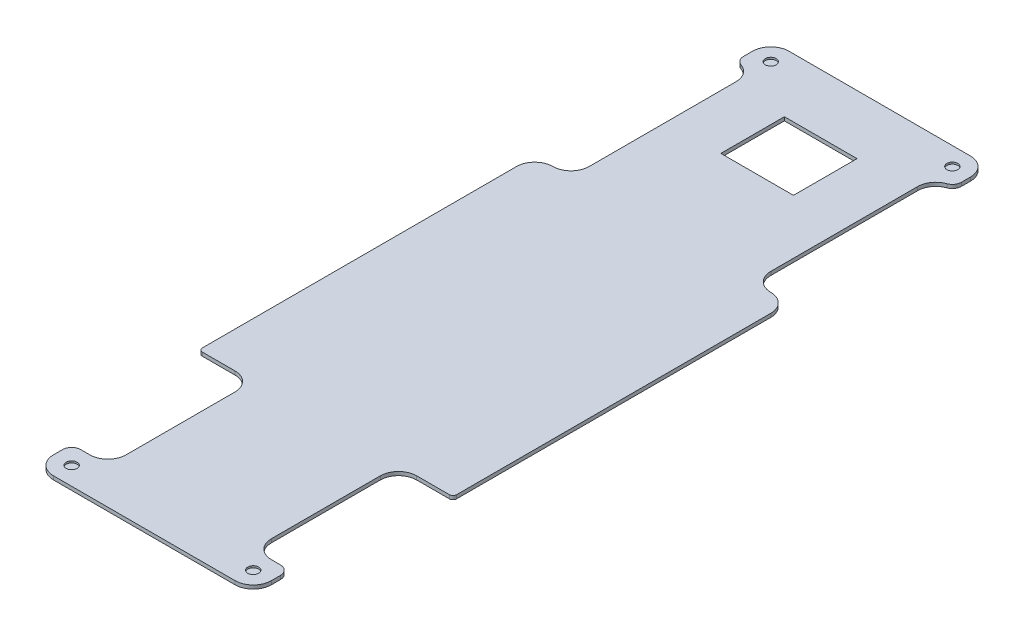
SolidWorks part; units mm, degrees
ref_plane "正面" through (0, 0, 0) normal (0, 0, 1) x (1, 0, 0)
ref_plane "平面" through (0, 0, 0) normal (0, 1, 0) x (1, 0, 0)
ref_plane "右側面" through (0, 0, 0) normal (1, 0, 0) x (0, 0, -1)
body saved out of another part "ｽﾄｯｸ-ORカー構想-1"
sketch "ｽｹｯﾁ1" plane through (0, -20, 0) normal (0, -1, 0) x (1, 0, 0)
  line L0 (40, 55) -> (-40, 55) construction
  line L1 (-50, 55) -> (50, 55)
  line L2 (-60, 45) -> (-60, 40)
  line L3 (-55, 35) -> (55, 35)
  line L4 (60, 45) -> (60, 40)
  line L5 (0, 55) -> (0, -350) construction
  line L6 (-60, 0) -> (-60, 71.566) construction
  line L7 (-50, -350) -> (50, -350) construction
  line L8 (-119.9521, -147.5) -> (119.9521, -147.5) construction
  line L9 (60, -340) -> (60, -335)
  line L10 (-55, -330) -> (55, -330)
  line L11 (-60, -340) -> (-60, -335)
  line L12 (-50, -350) -> (50, -350)
  arc A0 (-50, 55) -> (-60, 45) centre (-50, 45) ccw
  arc A1 (50, 55) -> (60, 45) centre (50, 45) cw
  arc A2 (-60, 40) -> (-55, 35) centre (-55, 40) ccw
  arc A3 (55, 35) -> (60, 40) centre (55, 40) ccw
  arc A4 (55, -330) -> (60, -335) centre (55, -335) cw
  arc A5 (-60, -335) -> (-55, -330) centre (-55, -335) cw
  arc A6 (50, -350) -> (60, -340) centre (50, -340) ccw
  arc A7 (-50, -350) -> (-60, -340) centre (-50, -340) cw
  point P16 (60, 55)
  point P21 (60, 35)
  point P26 (0, -147.5)
  point P39 (60, -330)
  point P40 (60, -350)
  dimension "D2" = 10
  dimension "D3" = 5
  dimension "D1" = 20
extrude "押し出し1" add sketch "ｽｹｯﾁ1" against normal up to surface (2 mm away)
fillet "ﾌｨﾚｯﾄ1" radius 10 10 edges at (50, -19, -330) (70, -19, -230) (50, -19, -230) (-50, -19, -330) (-50, -19, -230) (-70, -19, -230) (-40, -19, 35) (-40, -19, -45) (40, -19, -45) (40, -19, 35)
sketch "ｽｹｯﾁ3" plane through (0, -18, 0) normal (0, 1, 0) x (1, 0, 0)
  line L0 (68, 45) -> (70, 45)
  line L1 (70, 45) -> (70, 47)
  line L2 (-68, 45) -> (-70, 45)
  line L3 (-70, 45) -> (-70, 47)
  arc A0 (68, 45) -> (70, 47) centre (68, 47) ccw construction
  arc A1 (68, 45) -> (70, 47) centre (68, 47) ccw
  arc A2 (-70, 47) -> (-68, 45) centre (-68, 47) ccw construction
  arc A3 (-70, 47) -> (-68, 45) centre (-68, 47) ccw
extrude "ｶｯﾄ - 押し出し1" cut sketch "ｽｹｯﾁ3" against normal through all
sketch "ｽｹｯﾁ4" plane through (0, -20, 0) normal (0, -1, 0) x (1, 0, 0)
  line L0 (-90, -300) -> (90, -300) construction
  line L1 (-90, -298) -> (-90, -302) construction
  line L2 (90, -302) -> (90, -298) construction
  line L3 (0, -350) -> (0, -231.9382) construction
  line L4 (-50, -350) -> (50, -350) construction
  line L6 (-20, -282.5) -> (20, -282.5)
  line L7 (-20, -282.5) -> (-20, -317.5)
  line L8 (-20, -317.5) -> (20, -317.5)
  line L9 (20, -282.5) -> (20, -317.5)
  dimension "D1" = 40
  dimension "D2" = 35
extrude "ｶｯﾄ - 押し出し2" cut sketch "ｽｹｯﾁ4" against normal through all
sketch "ボデー支えピン受け" plane through (0, -18, 0) normal (0, 1, 0) x (1, 0, 0)
  circle A0 centre (50, -45) radius 3
  circle A1 centre (-50, -45) radius 3
  circle A2 centre (50, 340) radius 3
  circle A3 centre (-50, 340) radius 3
  dimension "D1" = 6
extrude "ｶｯﾄ - 押し出し3" cut sketch "ボデー支えピン受け" against normal blind 1
